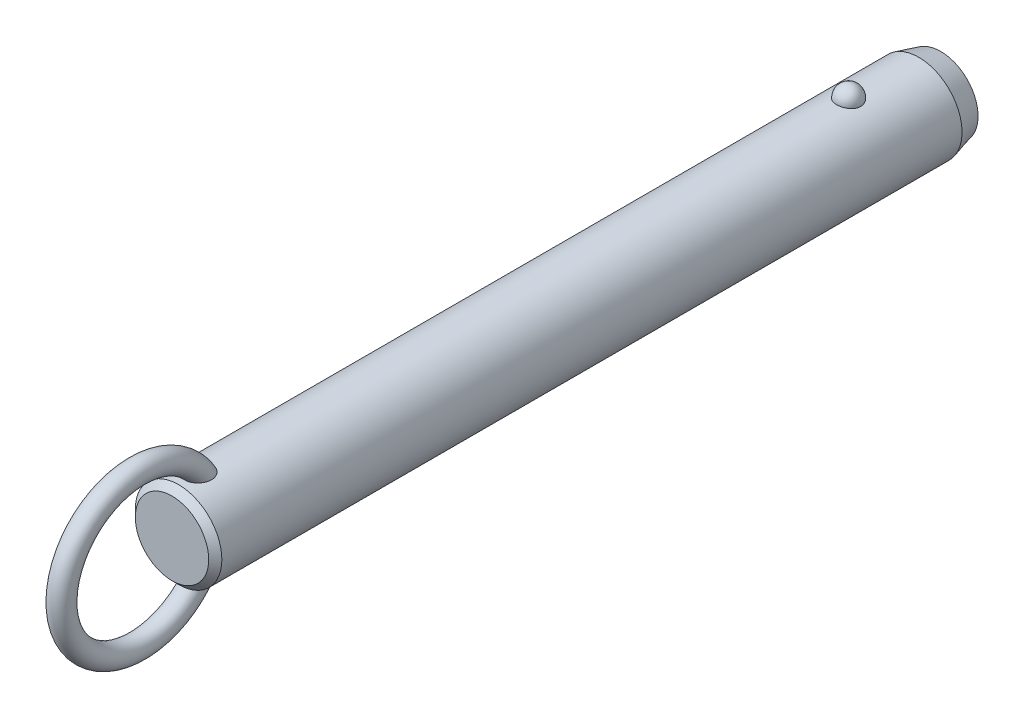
SolidWorks part; units mm, degrees
ref_plane "Front Plane" through (0, 0, 0) normal (0, 0, 1) x (1, 0, 0)
ref_plane "Top Plane" through (0, 0, 0) normal (0, 1, 0) x (1, 0, 0)
ref_plane "Right Plane" through (0, 0, 0) normal (1, 0, 0) x (0, 0, -1)
sketch "Sketch2" plane through (0, 0, 0) normal (0, 0, 1) x (1, 0, 0)
  circle A0 centre (0, 0) radius 7.9
  point P3 (0, 7.9)
  dimension "D1" = 15.8
extrude "Boss-Extrude1" add sketch "Sketch2" along normal blind 111.8
sketch "Sketch3" plane through (0, 0, 0) normal (0, 0, -1) x (-1, 0, 0)
  circle A0 centre (0, 0) radius 7.9
  dimension "D1" = 15.8
extrude "Boss-Extrude2" add sketch "Sketch3" along normal blind 19
chamfer "Chamfer1" distance 4 angle 15 1 edges at (-7.9, 0, -19)
sketch "Sketch12" plane through (0, 0, 0) normal (1, 0, 0) x (0, 0, -1)
  line L0 (-111.8, 7.9) -> (-111.8, -7.9) construction
  point P0 (-111.8, 0)
sketch "Sketch13" plane through (0, 0, 0) normal (1, 0, 0) x (0, 0, -1)
  circle A0 centre (-127.65, 0) radius 15.85
  point P2 (-111.8, 0)
  dimension "D1" = 31.7
sketch "Sketch14" plane through (0, 0, 0) normal (0, 1, 0) x (1, 0, 0)
  circle A0 centre (0, -113.8) radius 2
  point P2 (0, -111.8)
  dimension "D1" = 4
sweep "Sweep1" add profiles "Sketch14" path "Sketch13"
sketch "Sketch15" plane through (0, 0, 111.8) normal (0, 0, 1) x (1, 0, 0)
  circle A0 centre (0, 0) radius 7.9
  dimension "D1" = 15.8
extrude "Boss-Extrude3" add sketch "Sketch15" along normal blind 9.52
chamfer "Chamfer2" distance 1.2 angle 45 1 edges at (7.9, 0, 121.32)
sketch "Sketch18" plane through (0, 0, 0) normal (1, 0, 0) x (0, 0, -1)
  line L0 (15, 7.9) -> (-113.9091, 7.9) construction
  line L1 (2.2, 10.1) -> (2.2, 5.7)
  line L2 (-113.9091, -7.9) -> (15, -7.9) construction
  arc A0 (2.2, 10.1) -> (2.2, 5.7) centre (2.2, 7.9) ccw
  point P4 (0, 7.9)
  dimension "D1" = 18
revolve "Revolve1" add sketch "Sketch18" angle 360 about L1
